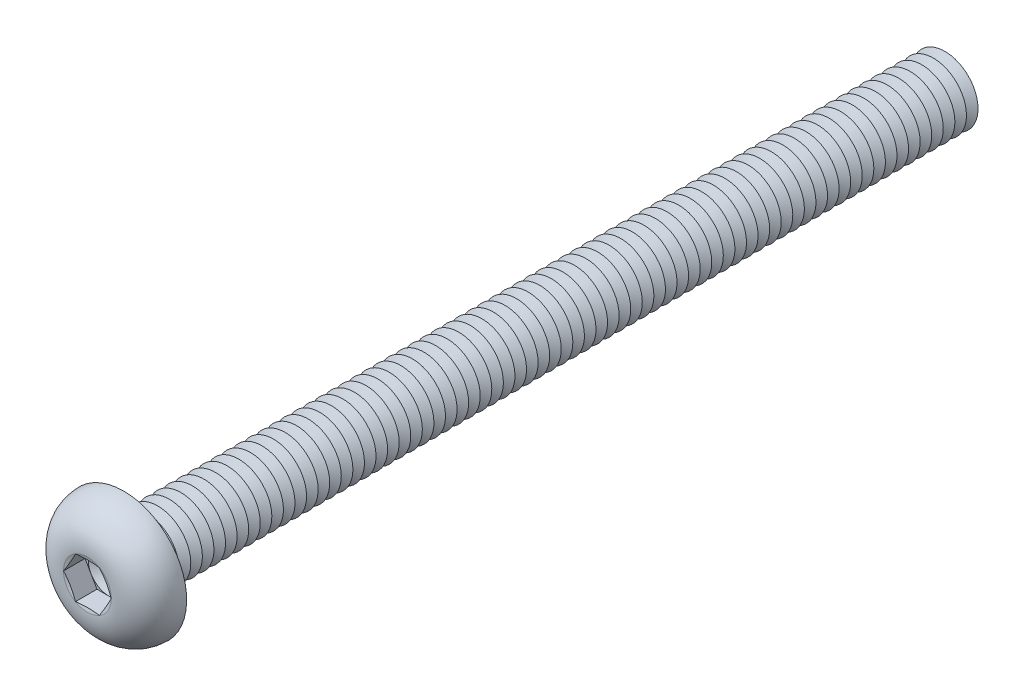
SolidWorks part; units mm, degrees
ref_plane "Front Plane" through (0, 0, 0) normal (0, 0, 1) x (1, 0, 0)
ref_plane "Top Plane" through (0, 0, 0) normal (0, 1, 0) x (1, 0, 0)
ref_plane "Right Plane" through (0, 0, 0) normal (1, 0, 0) x (0, 0, -1)
sketch "Sketch1" plane through (0, 0, 0) normal (1, 0, 0) x (0, 0, -1)
  line L0 (0, 2) -> (0, 3.8)
  line L3 (0, 2) -> (50, 2)
  line L4 (50, 2) -> (50, 0)
  line L5 (50, 0) -> (-2.2, 0) construction
  line L6 (-2.2, 0) -> (50, 0)
  line L7 (-2.2, 1.4434) -> (-2.2, 0.7217) construction
  line L8 (-2.2, 0.7217) -> (-2.2, 0)
  line L9 (-2.2, 1.4434) -> (-2.0066, 0.7217)
  line L10 (-2.0066, 0.7217) -> (-2.2, 0.7217)
  line L11 (50, 0) -> (22.7481, 0) construction
  line L12 (0, 3.8) -> (-2.2, 3.8) construction
  arc A1 (0, 3.8) -> (-2.2, 1.4434) centre (0, 1.5948) ccw
  point P8 (50, 1)
  dimension "D1" = 7.6
  dimension "D2" = 4
  dimension "D3" = 2.2
  dimension "D4" = 2.8868
  dimension "D5" = 50
  dimension "D6" = 15
revolve "Revolve1" add sketch "Sketch1" angle 360 about L5
fillet "Fillet1" radius 0.35 1 edges at (0, 2, 0)
sketch "Sketch2" plane through (0, 0, 0) normal (1, 0, 0) x (0, 0, -1)
  line L0 (49.65, 2) -> (50.35, 2)
  line L1 (50, 2) -> (0.35, 2) construction
  line L2 (50.35, 2) -> (50, 1.3938)
  line L3 (50, -2) -> (50, 2) construction
  line L4 (50, 1.3938) -> (49.65, 2)
  dimension "D1" = 0.7
revolve "Cut-Revolve1" cut sketch "Sketch2" angle 360 about axis through (0, 0, -50) along (0, 0, -1)
pattern_linear "LPattern1" count 71 spacing 0.7 along (0, 0, 1) of "Cut-Revolve1"
sketch "Sketch3" plane through (0, 0, 2.2) normal (0, 0, 1) x (1, 0, 0)
  line L7 (0.7217, 1.25) -> (-0.7217, 1.25)
  line L8 (-0.7217, 1.25) -> (-1.4434, 0)
  line L9 (-1.4434, 0) -> (-0.7217, -1.25)
  line L10 (-0.7217, -1.25) -> (0.7217, -1.25)
  line L11 (0.7217, -1.25) -> (1.4434, 0)
  line L12 (1.4434, 0) -> (0.7217, 1.25)
  circle A0 centre (0, 0) radius 1.25 construction
  circle A3 centre (0, 0) radius 1.4434 construction
extrude "Cut-Extrude1" cut sketch "Sketch3" against normal blind 1.3
sketch "Sketch4" plane through (0, 0, 0.9) normal (0, 0, 1) x (1, 0, 0)
  line L1 (0.7217, 1.25) -> (-0.7217, 1.25) construction
  circle A0 centre (0, 0) radius 1.25
extrude "Cut-Extrude2" cut sketch "Sketch4" against normal through all draft 60
